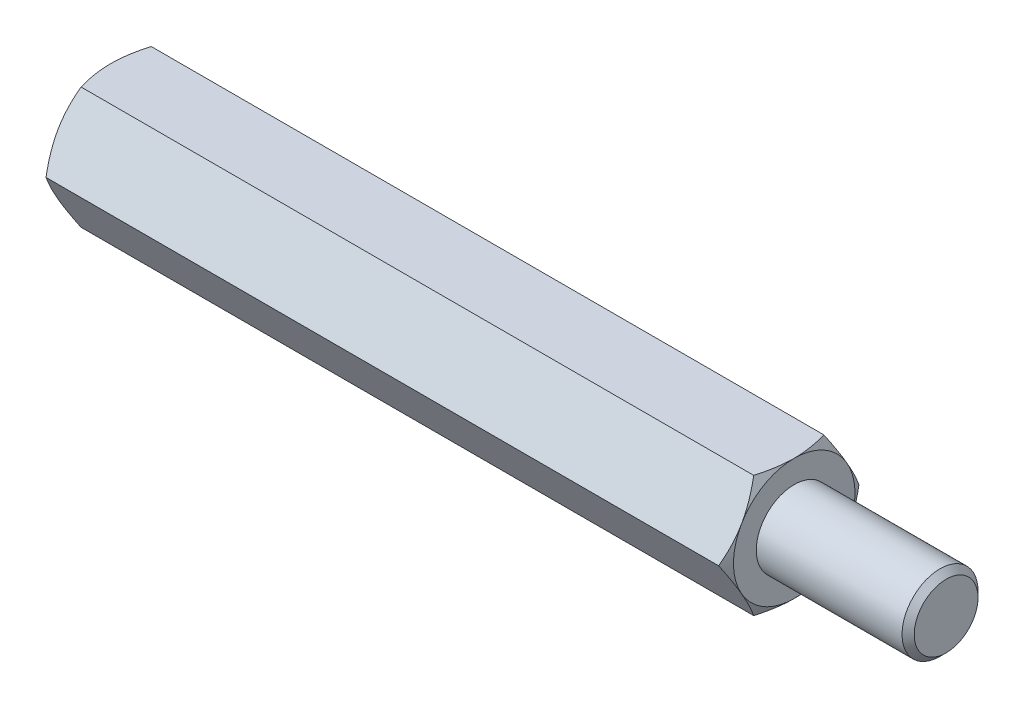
SolidWorks part; units mm, degrees
ref_plane "Front Plane" through (0, 0, 0) normal (0, 0, 1) x (1, 0, 0)
ref_plane "Top Plane" through (0, 0, 0) normal (0, 1, 0) x (1, 0, 0)
ref_plane "Right Plane" through (0, 0, 0) normal (1, 0, 0) x (0, 0, -1)
sketch "Sketch1" plane through (0, 0, 0) normal (1, 0, 0) x (0, 0, -1)
  line L1 (2.3094, 4) -> (-2.3094, 4)
  line L2 (-2.3094, 4) -> (-4.6188, 0)
  line L3 (-4.6188, 0) -> (-2.3094, -4)
  line L4 (-2.3094, -4) -> (2.3094, -4)
  line L5 (2.3094, -4) -> (4.6188, 0)
  line L6 (4.6188, 0) -> (2.3094, 4)
  circle A0 centre (0, 0) radius 4 construction
  dimension "D1" = 8
extrude "Extrude2" add sketch "Sketch1" along normal mid plane 45
sketch "Sketch2" plane through (0, 0, 0) normal (0, 0, 1) x (1, 0, 0)
  line L0 (-22.5, 4) -> (-21, 6.5981)
  line L1 (-22.5, 7) -> (-22.5, 4)
  line L3 (0, 0) -> (50000, 0) construction
  arc A0 (-21, 6.5981) -> (-22.5, 7) centre (-21.6962, 7) ccw
  dimension "D1" = 30
  dimension "D2" = 3
revolve "Cut-Revolve1" cut sketch "Sketch2" angle 360 about L3
mirror "Mirror1" about plane through (0, 0, 0) normal (1, 0, 0) of "Cut-Revolve1"
sketch "Sketch3" plane through (-22.5, 0, 0) normal (-1, 0, 0) x (0, 0, 1)
  circle A0 centre (0, 0) radius 2.1
  dimension "D1" = 4.2
extrude "Extrude3" cut sketch "Sketch3" against normal blind 10
sketch "Sketch4" plane through (0, 0, 0) normal (0, 0, 1) x (1, 0, 0)
  line L0 (-12.5, 0) -> (-12.5, 2.1)
  line L1 (22.1427, 0) -> (-22.1427, 0) construction
  line L2 (-12.5, 2.1) -> (-11.2876, 0)
  line L3 (-11.2876, 0) -> (-12.5, 0)
  line L4 (-22.5, 2) -> (-22.5, -2) construction
  point P4 (-22.5, 0)
  dimension "D1" = 30
  dimension "D2" = 2.1
  dimension "D3" = 10
revolve "Cut-Revolve2" cut sketch "Sketch4" angle 360 about L3
sketch "Sketch5" plane through (22.5, 0, 0) normal (1, 0, 0) x (0, 0, -1)
  circle A0 centre (0, 0) radius 2.5
  dimension "D1" = 5
extrude "Extrude4" add sketch "Sketch5" along normal blind 10
chamfer "Chamfer1" distance 0.4 angle 45 1 edges at (32.5, 0, -2.5)
equation "\"D2@Sketch4\" = \"D1@Sketch3\"/2"
